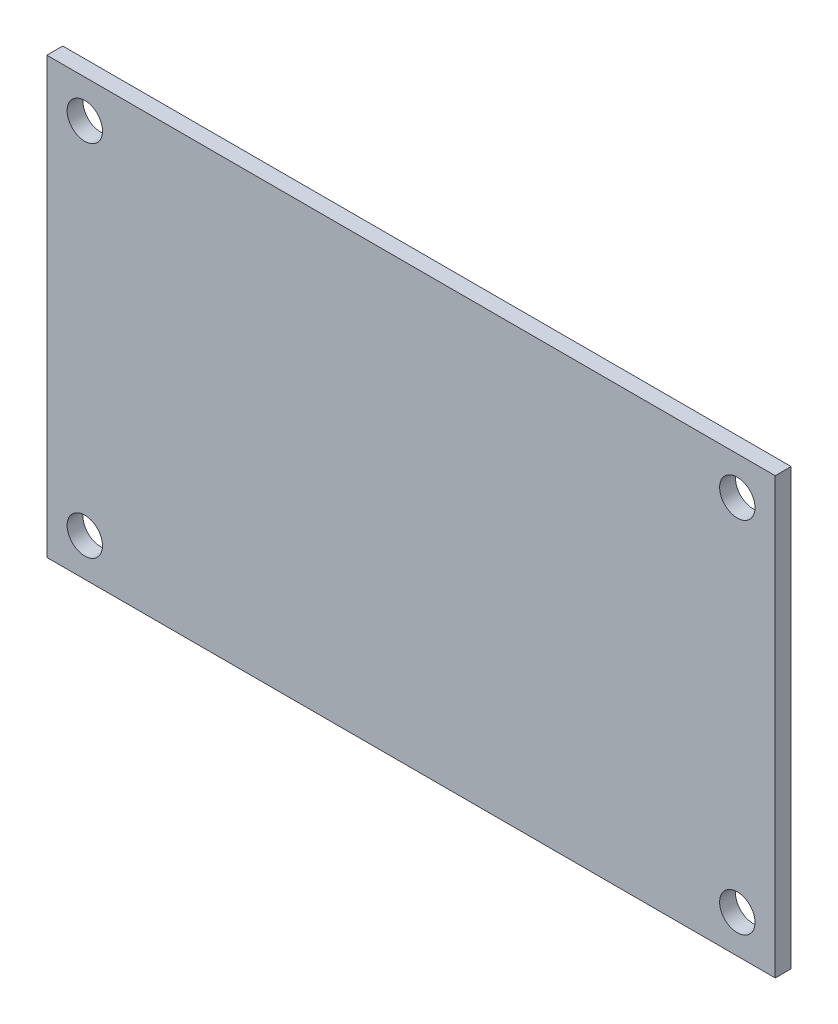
SolidWorks part; units mm, degrees
ref_plane "Plan de face" through (0, 0, 0) normal (0, 0, 1) x (1, 0, 0)
ref_plane "Plan de dessus" through (0, 0, 0) normal (0, 1, 0) x (1, 0, 0)
ref_plane "Plan de droite" through (0, 0, 0) normal (1, 0, 0) x (0, 0, -1)
sketch "Esquisse1" plane through (0, 0, 0) normal (0, 0, 1) x (1, 0, 0)
  line L1 (-52.859, 20.6815) -> (19.141, 20.6815)
  line L2 (-52.859, 20.6815) -> (-52.859, -22.3185)
  line L3 (-52.859, -22.3185) -> (19.141, -22.3185)
  line L4 (19.141, 20.6815) -> (19.141, -22.3185)
  circle A0 centre (-49.109, 16.9315) radius 1.75
  circle A1 centre (15.391, 16.9315) radius 1.75
  circle A2 centre (-49.109, -18.5685) radius 1.75
  circle A3 centre (15.391, -18.5685) radius 1.75
  dimension "D3" = 3.5
  dimension "D4" = 3.5
  dimension "D5" = 3.5
  dimension "D6" = 3.5
  dimension "D1" = 72
  dimension "D2" = 43
  dimension "D7" = 35.5
  dimension "D8" = 3.75
  dimension "D9" = 35.5
  dimension "D10" = 3.75
  dimension "D11" = 64.5
  dimension "D12" = 3.75
extrude "Boss.-Extru.1" add sketch "Esquisse1" along normal blind 1.57
